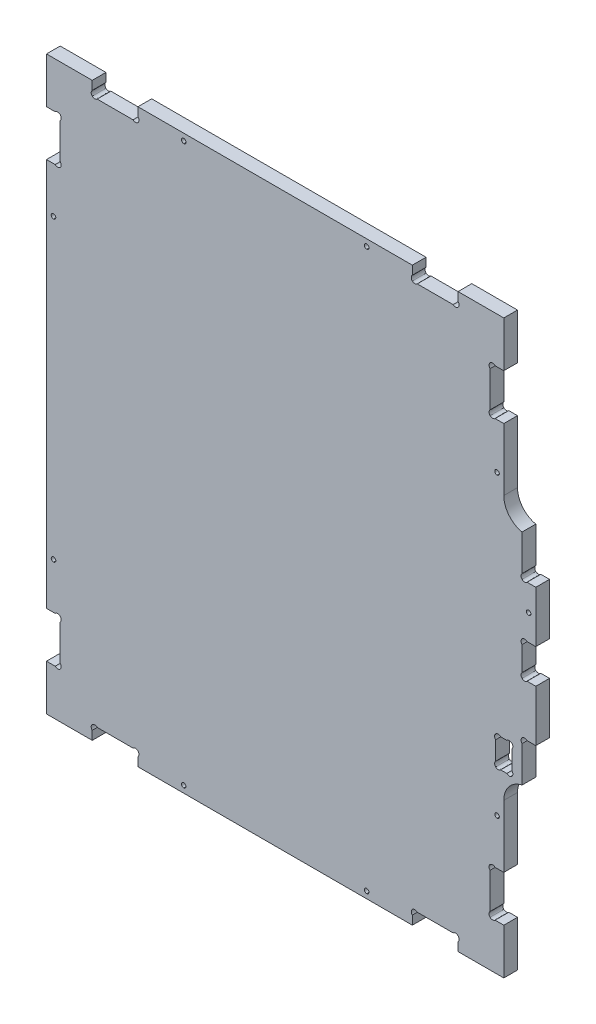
SolidWorks part; units mm, degrees
ref_plane "Plan de face" through (0, 0, 0) normal (0, 0, 1) x (1, 0, 0)
ref_plane "Plan de dessus" through (0, 0, 0) normal (0, 1, 0) x (1, 0, 0)
ref_plane "Plan de droite" through (0, 0, 0) normal (1, 0, 0) x (0, 0, -1)
body saved out of another part "Stock-Pièce3-1"
sketch "Esquisse1" plane through (0, 0, 6) normal (0, 0, 1) x (1, 0, 0)
  line L0 (2291.9366, 485.2781) -> (2300.9366, 485.2781) construction
  line L1 (2296.4366, 485.2781) -> (2280.9366, 485.2781)
  line L2 (2296.4366, 485.2781) -> (2296.4366, 469.7781)
  line L3 (2296.4366, 469.7781) -> (2280.9366, 469.7781)
  line L4 (2280.9366, 485.2781) -> (2280.9366, 469.7781)
  line L5 (2280.9366, 465.2781) -> (2280.9366, 474.2781) construction
  line L6 (2460.9366, 485.2781) -> (2469.9366, 485.2781) construction
  line L7 (2465.4366, 485.2781) -> (2480.9366, 485.2781)
  line L8 (2465.4366, 485.2781) -> (2465.4366, 469.7781)
  line L9 (2465.4366, 469.7781) -> (2480.9366, 469.7781)
  line L10 (2480.9366, 485.2781) -> (2480.9366, 469.7781)
  line L11 (2480.9366, 474.2781) -> (2480.9366, 465.2781) construction
  line L12 (2480.9366, 255.2781) -> (2480.9366, 246.2781) construction
  line L13 (2480.9366, 250.7781) -> (2465.4366, 250.7781)
  line L14 (2480.9366, 250.7781) -> (2480.9366, 235.2781)
  line L15 (2480.9366, 235.2781) -> (2465.4366, 235.2781)
  line L16 (2465.4366, 250.7781) -> (2465.4366, 235.2781)
  line L17 (2469.9366, 235.2781) -> (2460.9366, 235.2781) construction
  line L18 (2280.9366, 246.2781) -> (2280.9366, 255.2781) construction
  line L19 (2280.9366, 250.7781) -> (2296.4366, 250.7781)
  line L20 (2280.9366, 250.7781) -> (2280.9366, 235.2781)
  line L21 (2280.9366, 235.2781) -> (2296.4366, 235.2781)
  line L22 (2296.4366, 250.7781) -> (2296.4366, 235.2781)
  line L23 (2300.9366, 235.2781) -> (2291.9366, 235.2781) construction
extrude "Boss.-Extru.1" add sketch "Esquisse1" against normal up to surface (6 mm away)
